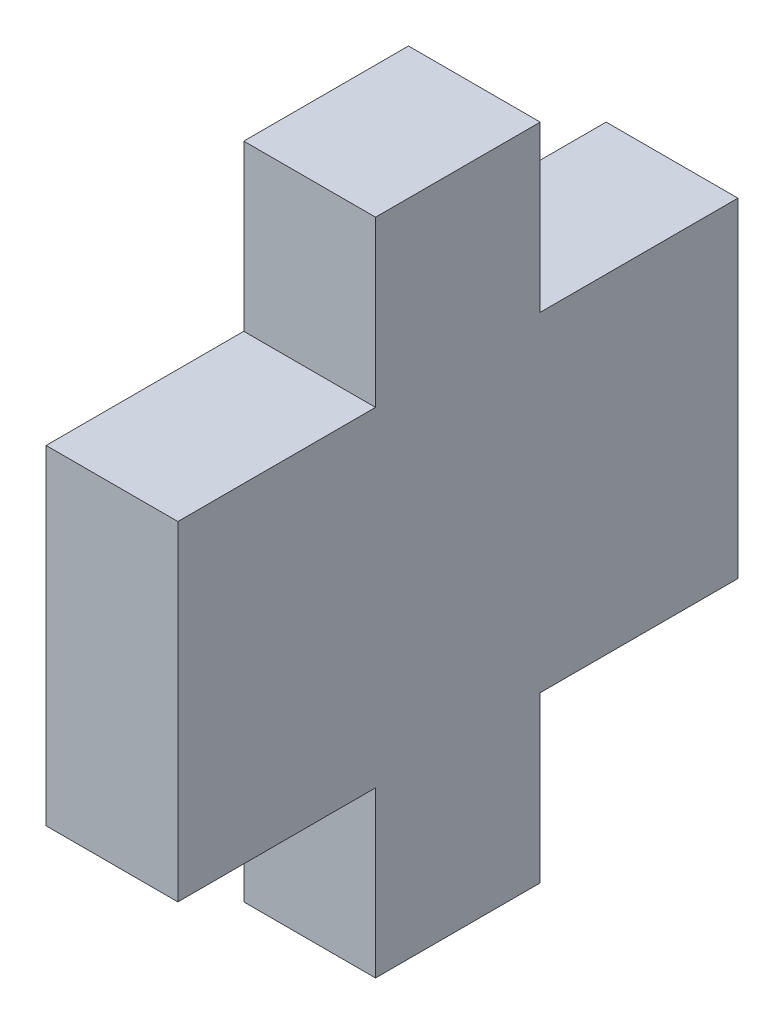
SolidWorks part; units mm, degrees
ref_plane "Front Plane" through (0, 0, 0) normal (0, 0, 1) x (1, 0, 0)
ref_plane "Top Plane" through (0, 0, 0) normal (0, 1, 0) x (1, 0, 0)
ref_plane "Right Plane" through (0, 0, 0) normal (1, 0, 0) x (0, 0, -1)
sketch "Sketch1" plane through (0, 0, 0) normal (1, 0, 0) x (0, 0, -1)
  line L0 (0, 0) -> (51.4684, 0) construction
  line L1 (0, -25) -> (0, 25)
  line L2 (0, 25) -> (30, 25)
  line L3 (0, -25) -> (30, -25)
  line L4 (30, 25) -> (30, 50)
  line L5 (30, -25) -> (30, -50)
  line L6 (30, 50) -> (55, 50)
  line L7 (30, -50) -> (55, -50)
  line L8 (55, 50) -> (55, 25)
  line L9 (55, -50) -> (55, -25)
  line L10 (55, 25) -> (85, 25)
  line L11 (55, -25) -> (85, -25)
  line L12 (85, 25) -> (85, -25)
  point P15 (85, 0)
  point P16 (0, 0)
  dimension "D1" = 25
  dimension "D2" = 25
  dimension "D3" = 30
  dimension "D4" = 25
  dimension "D5" = 30
extrude "Extrude1" add sketch "Sketch1" along normal mid plane 20
